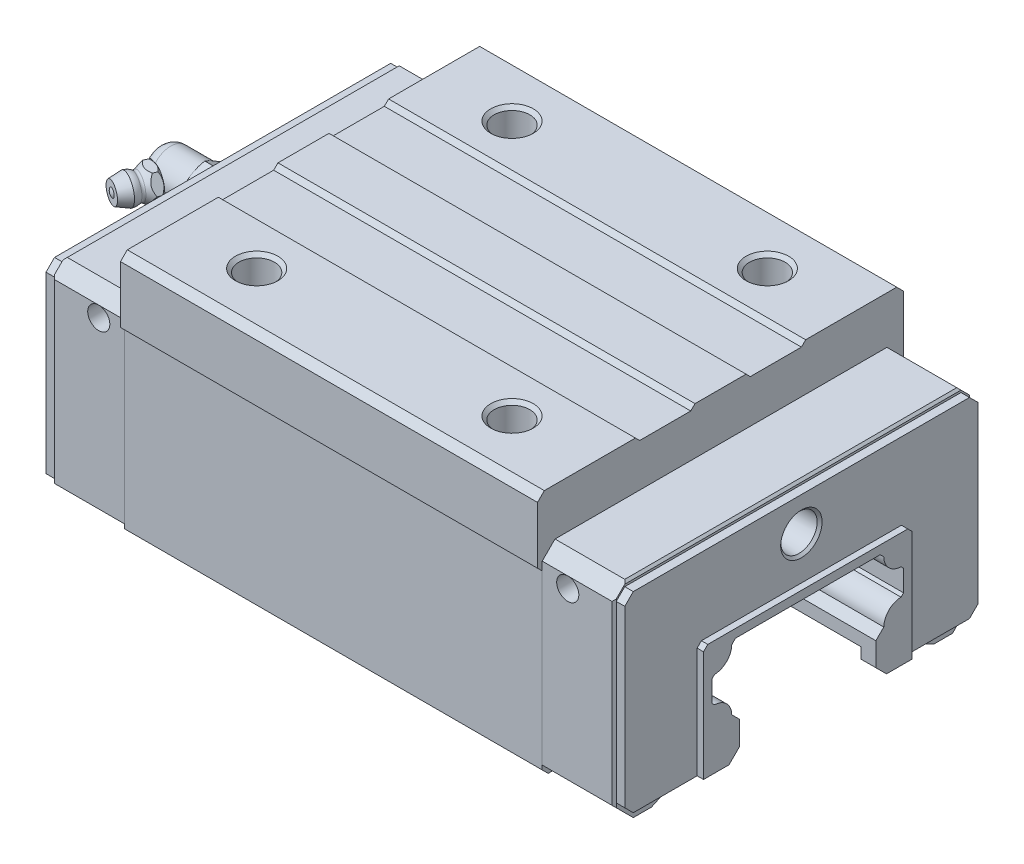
SolidWorks part; units mm, degrees
ref_plane "Front Plane" through (0, 0, 0) normal (0, 0, 1) x (1, 0, 0)
ref_plane "Top Plane" through (0, 0, 0) normal (0, 1, 0) x (1, 0, 0)
ref_plane "Right Plane" through (0, 0, 0) normal (1, 0, 0) x (0, 0, -1)
imported_body "HSR45R1SS-570L_G22-5_0_B-PT18_199-6_0_0_0_1(R2).stp-1/_HSR45RSSB-PT1_81 Slider-1-R2.stp-1-solid1"
imported_body "HSR45R1SS-570L_G22-5_0_B-PT18_199-6_0_0_0_1(R2).stp-1/_hsr_ftht_B-PT1_8_grease_nipple_joint.stp-1-solid1"
move or copy body "Body-Move/Copy1" bodies to move or copy 104 103 copy no translate (-246.6, 0, 0)
